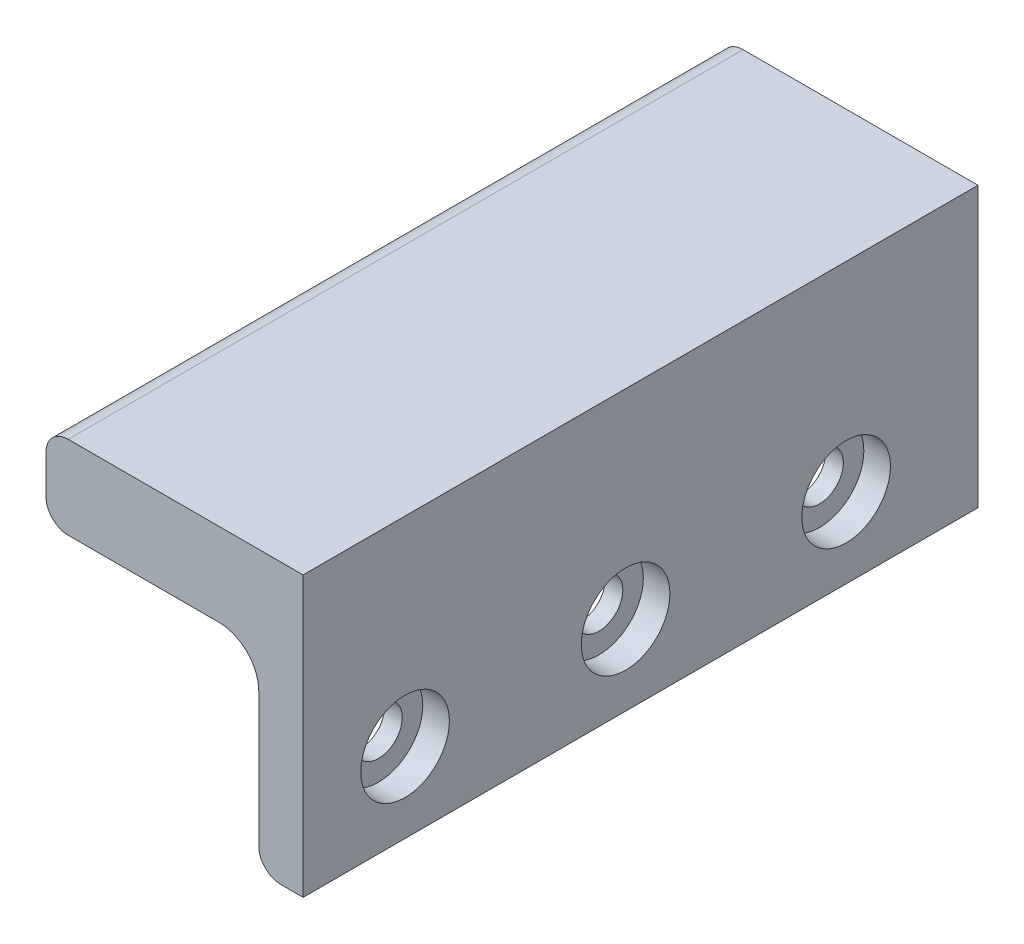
SolidWorks part; units mm, degrees
other "DetailItem1"
other "DetailItem2"
other "DetailItem6"
other "DetailItem7"
other "DetailItem3"
other "DetailItem4"
other "DetailItem5"
ref_plane "Front" through (0, 0, 0) normal (0, 0, 1) x (1, 0, 0)
ref_plane "Top" through (0, 0, 0) normal (0, 1, 0) x (1, 0, 0)
ref_plane "Right" through (0, 0, 0) normal (1, 0, 0) x (0, 0, -1)
sketch "Sketch1" plane through (0, 0, 0) normal (0, 0, 1) x (1, 0, 0)
  line L0 (0, -7.5) -> (19.2, -7.5)
  line L1 (0, 0) -> (23.2, 0)
  line L2 (0, 0) -> (0, -7.5)
  line L3 (19.2, -25.2) -> (23.2, -25.2)
  line L4 (23.2, 0) -> (23.2, -25.2)
  line L5 (19.2, -7.5) -> (19.2, -25.2)
  dimension "D1" = 23.2
  dimension "D2" = 17.7
  dimension "D3" = 7.5
  dimension "D4" = 4
extrude "Extrude1" add sketch "Sketch1" against normal blind 60.9
hole_wizard "CBORE for M4 SHCS1" positions "Sketch3" profile "Sketch2" counterbore size "M4" standard "Ansi Metric"
sketch "Sketch3" plane through (23.2, 0, 0) normal (1, 0, 0) x (0, 0, -1)
  line L0 (60.9, 0) -> (0, 0) construction
  line L1 (0, -25.2) -> (0, 0) construction
  point P0 (9.2, -18)
  point P5 (29.1, -18)
  point P6 (49, -18)
  dimension "D1" = 18
  dimension "D2" = 9.2
  dimension "D3" = 29.1
  dimension "D4" = 49
sketch "Sketch2" plane through (23.2, -18, -9.2) normal (0, 1, 0) x (0, 0, -1)
  line L0 (0, 0) -> (0, 23.2)
  line L1 (0, 23.2) -> (2.15, 23.2)
  line L3 (2.15, 23.2) -> (2.15, 2.4)
  line L4 (2.15, 2.4) -> (4, 2.4)
  line L5 (4, 2.4) -> (4, 0)
  line L7 (4, 0) -> (0, 0)
  line L11 (0, -6.35) -> (0, 107.95) construction
  dimension "Thru Hole Dia." = 4.3
  dimension "Thru Hole Depth" = 23.2
  dimension "C'Bore Dia." = 8
  dimension "C'Bore Depth" = 2.4
fillet "Fillet1" radius 2 3 edges at (0, 0, -30.45) (0, -7.5, -30.45) (19.2, -25.2, -30.45)
fillet "Fillet4" radius 3.6 1 edges at (19.2, -7.5, -30.45)
sketch "Sketch4" plane through (0, 0, 0) normal (0, 1, 0) x (-1, 0, 0)
  line L0 (-20.8, -29.1) -> (-23.2, -29.1) construction
  line L1 (8.9711, -29.1) -> (-31.9824, -29.1)
  line L2 (8.9711, -29.1) -> (8.9711, 0)
  line L3 (8.9711, 0) -> (-31.9824, 0)
  line L4 (-31.9824, -29.1) -> (-31.9824, 0)
  line L5 (-23.2, 0) -> (-2, 0) construction
extrude "Cut-Extrude1" [suppressed] cut sketch "Sketch4" against normal through all
ref_plane "A" [suppressed] through (0, 0, -29.1) normal (0, 0, 1) x (1, 0, 0)
sketch "Sketch5" [suppressed] plane through (0, 0, -29.1) normal (0, 0, 1) x (1, 0, 0)
  line L0 (-28.5366, 1.9107) -> (-33.2485, -2.4767)
  line L1 (-28.5366, 1.9107) -> (35.3292, 1.9107)
  line L2 (-28.5366, 1.9107) -> (-28.5366, -26.6159)
  line L3 (-28.5366, -26.6159) -> (35.3292, -26.6159)
  line L4 (35.3292, 1.9107) -> (35.3292, -26.6159)
  line L5 (-33.2485, -2.4767) -> (-31.8264, -0.7444)
  line L6 (-33.2485, -2.4767) -> (-31.2782, -1.0411)
  text T0 "A" font "SWGDT" height 2
hole_wizard "M5.0 (5) Diameter Hole1" positions "Sketch7" profile "Sketch6" hole size "M5.0" standard "Ansi Metric"
sketch "Sketch7" plane through (0, -7.5, 0) normal (0, -1, 0) x (1, 0, 0)
  line L0 (2, -60.9) -> (15.6, -60.9) construction
  line L1 (0, -60.9) -> (0, 0) construction
  point P0 (10, -45.9)
  point P1 (10, -19.9)
  dimension "D1" = 26
  dimension "D2" = 15
  dimension "D3" = 10
sketch "Sketch6" plane through (10, -7.5, -45.9) normal (1, 0, 0) x (0, 0, -1)
  line L0 (0, 0) -> (0, 6.5022)
  line L1 (0, 6.5022) -> (2.5, 5)
  line L2 (2.5, 5) -> (2.5, 0)
  line L5 (2.5, 0) -> (0, 0)
  line L10 (0, 6.5022) -> (-2.5, 5) construction
  line L11 (0, -6.35) -> (0, 107.95) construction
  dimension "Hole Dia." = 5
  dimension "Hole Depth" = 5
  dimension "Drill Angle" = 118
